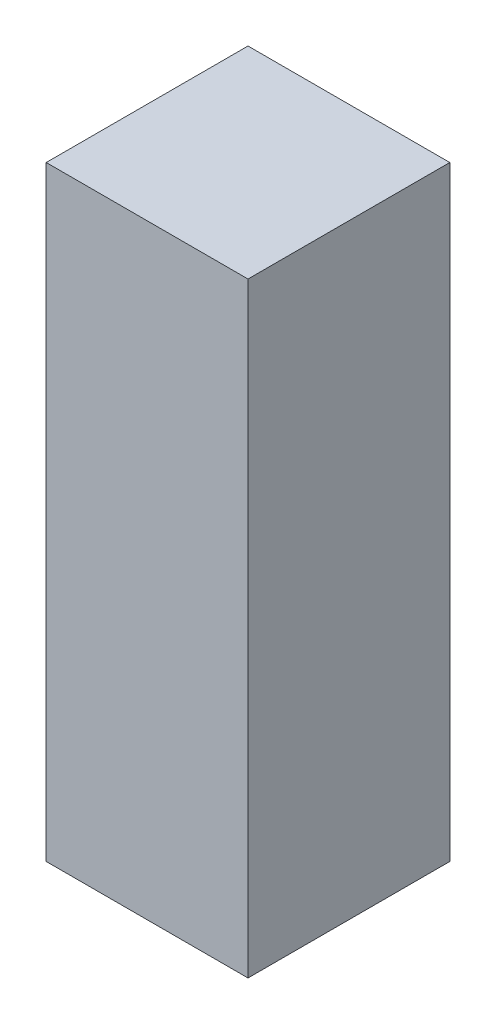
SolidWorks part; units mm, degrees
ref_plane "Front Plane" through (0, 0, 0) normal (0, 0, 1) x (1, 0, 0)
ref_plane "Top Plane" through (0, 0, 0) normal (0, 1, 0) x (1, 0, 0)
ref_plane "Right Plane" through (0, 0, 0) normal (1, 0, 0) x (0, 0, -1)
sketch "Sketch1" plane through (0, 0, 0) normal (0, 1, 0) x (1, 0, 0)
  line L1 (-0.635, -0.635) -> (0.635, -0.635)
  line L2 (-0.635, -0.635) -> (-0.635, 0.635)
  line L3 (-0.635, 0.635) -> (0.635, 0.635)
  line L4 (0.635, -0.635) -> (0.635, 0.635)
  line L5 (-0.635, -0.635) -> (0.635, 0.635) construction
  line L6 (-0.635, 0.635) -> (0.635, -0.635) construction
  point P0 (0, 0)
  dimension "D1" = 1.27
extrude "Boss-Extrude1" add sketch "Sketch1" along normal blind 3.81
